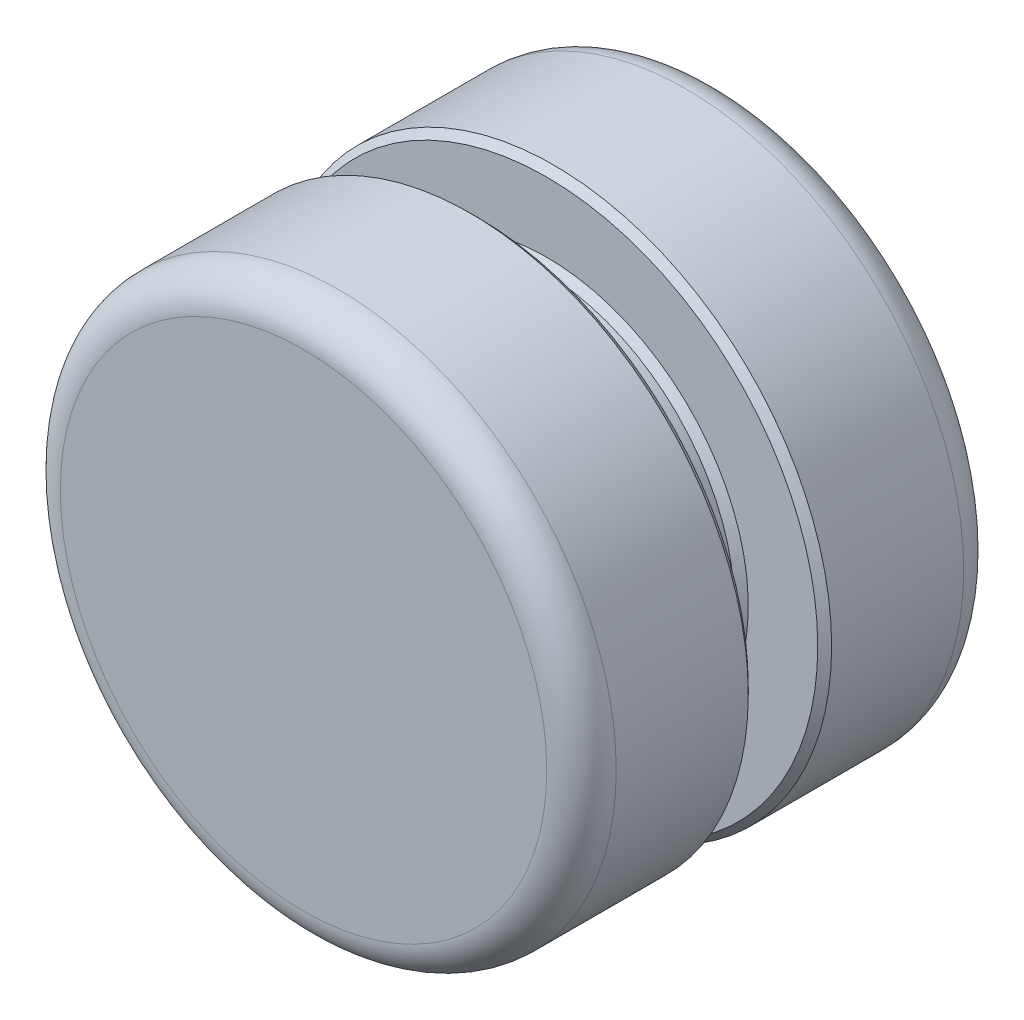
SolidWorks part; units mm, degrees
ref_plane "Спереди" through (0, 0, 0) normal (0, 0, 1) x (1, 0, 0)
ref_plane "Сверху" through (0, 0, 0) normal (0, 1, 0) x (1, 0, 0)
ref_plane "Справа" through (0, 0, 0) normal (1, 0, 0) x (0, 0, -1)
sketch "Эскиз1" plane through (0, 0, 0) normal (0, 0, 1) x (1, 0, 0)
  circle A0 centre (0, 0) radius 2.8
  dimension "D1" = 5.6
extrude "Бобышка-Вытянуть1" add sketch "Эскиз1" along normal blind 0.5
sketch "Эскиз2" plane through (0, 0, 0.5) normal (0, 0, 1) x (1, 0, 0)
  circle A0 centre (0, 0) radius 4
  dimension "D1" = 8
extrude "Бобышка-Вытянуть2" add sketch "Эскиз2" along normal blind 2.5
mirror "Зеркальное отражение1" about plane through (0, 0, 0) normal (0, 0, 1)
fillet "Скругление1" radius 0.5 2 edges at (4, 0, -3) (4, 0, 3)
chamfer "Фаска1" distance 0.1 angle 45 4 edges at (2.8, 0, 0.5) (4, 0, 0.5) (4, 0, -0.5) (2.8, 0, -0.5)
